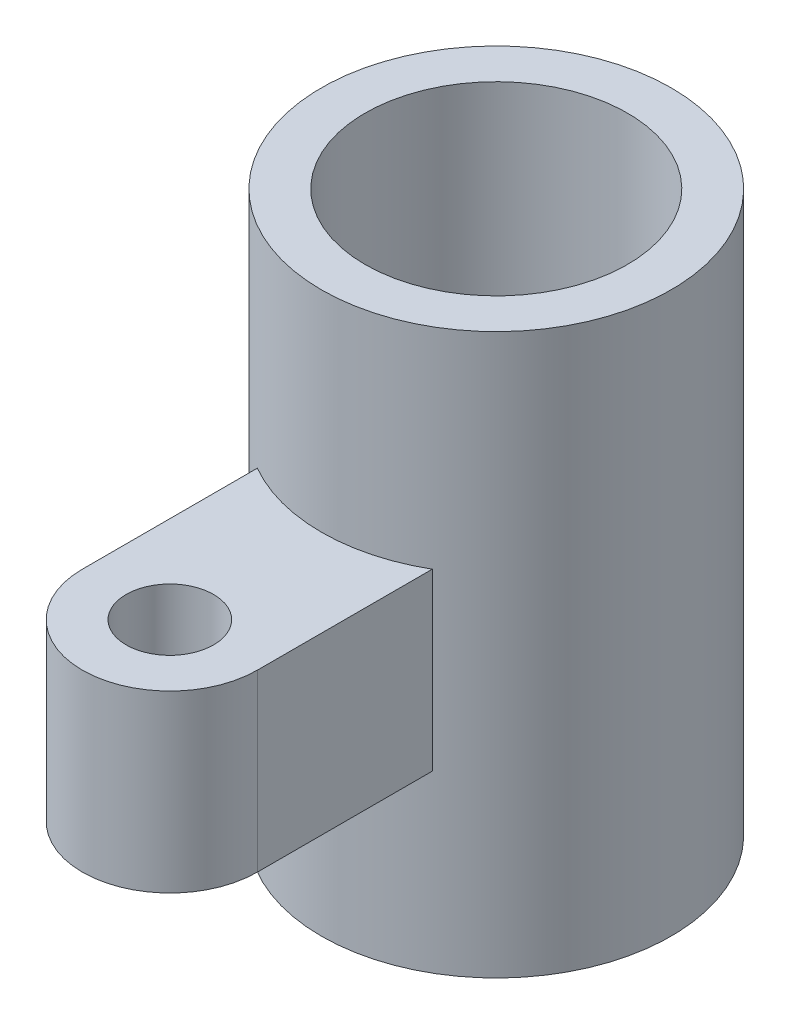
SolidWorks part; units mm, degrees
ref_plane "Alzado" through (0, 0, 0) normal (0, 0, 1) x (1, 0, 0)
ref_plane "Planta" through (0, 0, 0) normal (0, 1, 0) x (1, 0, 0)
ref_plane "Vista lateral" through (0, 0, 0) normal (1, 0, 0) x (0, 0, -1)
sketch "Croquis1" plane through (0, 0, 0) normal (0, 1, 0) x (1, 0, 0)
  circle A0 centre (0, 0) radius 15
  circle A1 centre (0, 0) radius 20
  dimension "D1" = 30
  dimension "D2" = 40
extrude "Saliente-Extruir1" add sketch "Croquis1" along normal blind 64
sketch "Croquis2" plane through (0, 0, 0) normal (0, 1, 0) x (1, 0, 0)
  line L0 (0, 0) -> (0, -17.3205) construction
  line L1 (-10, -17.3205) -> (10, -17.3205)
  line L2 (-10, -17.3205) -> (-10, -37.3205)
  line L4 (10, -17.3205) -> (10, -37.3205)
  circle A0 centre (0, 0) radius 20 construction
  arc A1 (-10, -37.3205) -> (10, -37.3205) centre (0, -37.3205) ccw
  circle A2 centre (0, -37.3205) radius 5
  dimension "D2" = 20
  dimension "D3" = 10
  dimension "D1" = 20
extrude "Saliente-Extruir2" add sketch "Croquis2" along normal blind 20 from offset 20
